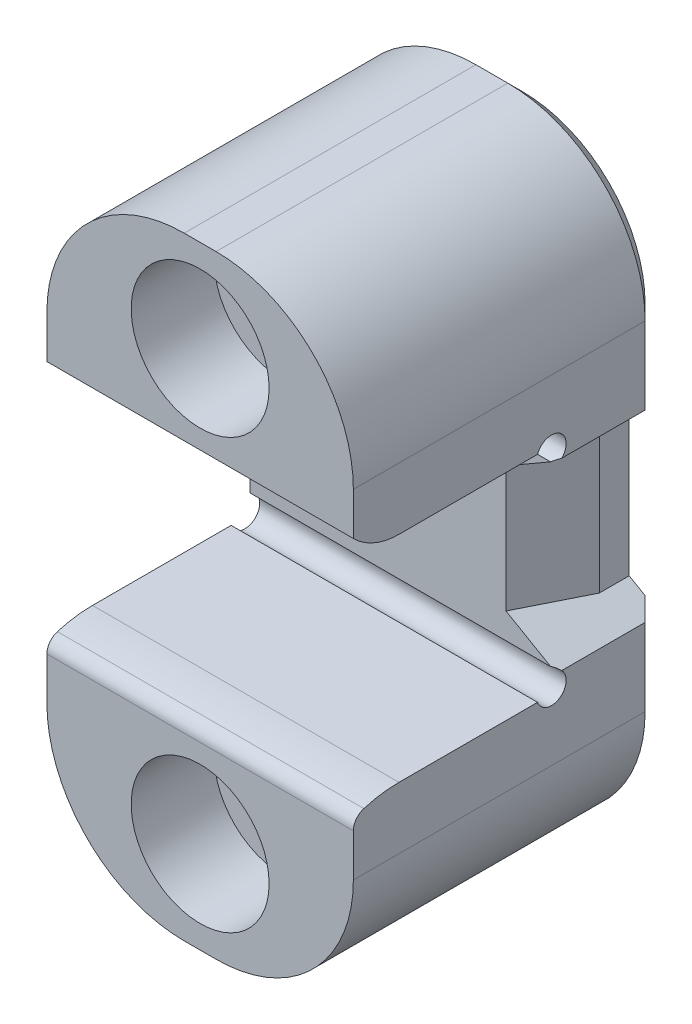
SolidWorks part; units mm, degrees
ref_plane "Front Plane" through (0, 0, 0) normal (0, 0, 1) x (1, 0, 0)
ref_plane "Top Plane" through (0, 0, 0) normal (0, 1, 0) x (1, 0, 0)
ref_plane "Right Plane" through (0, 0, 0) normal (1, 0, 0) x (0, 0, -1)
sketch "Sketch1" plane through (0, 0, 0) normal (1, 0, 0) x (0, 0, -1)
  line L0 (0, 0) -> (50000, 0) construction
  line L1 (0, 5.5626) -> (10.5156, 5.5626)
  line L2 (0, 15.875) -> (15.875, 15.875)
  line L3 (0, 15.875) -> (0, 5.5626)
  line L4 (0, -15.875) -> (15.875, -15.875)
  line L5 (15.875, 15.875) -> (15.875, -15.875)
  line L6 (10.5156, 5.5626) -> (10.5156, -5.5626)
  line L7 (10.5156, -5.5626) -> (0, -5.5626)
  line L9 (0, 8.7312) -> (0, -8.7312) construction
  line L10 (0, -5.5626) -> (0, -15.875)
  dimension "D1" = 15.875
  dimension "D2" = 31.75
  dimension "D3" = 10.5156
  dimension "D4" = 11.1252
extrude "Extrude1" add sketch "Sketch1" along normal mid plane 15.875
fillet "Fillet1" radius 7.112 4 edges at (-7.9375, -15.875, -7.9375) (-7.9375, 15.875, -7.9375) (7.9375, -15.875, -7.9375) (7.9375, 15.875, -7.9375)
sketch "Sketch2" plane through (-7.9375, 0, -15.875) normal (0, 0, 1) x (1, 0, 0)
  line L0 (0, 0) -> (50000, 0) construction
  line L1 (15.875, -8.763) -> (15.875, 8.763) construction
  line L2 (14.2875, 3.846) -> (17.4625, 5.679)
  line L3 (14.2875, 3.846) -> (14.2875, -3.846)
  line L4 (14.2875, -3.846) -> (17.4625, -5.679)
  line L5 (17.4625, 5.679) -> (17.4625, -5.679)
  point P4 (15.875, 4.7625)
  point P10 (15.875, -4.7625)
  dimension "D1" = 9.525
  dimension "D2" = 1.5875
  dimension "D3" = 30
  dimension "D4" = 3.175
extrude "Cut-Extrude1" cut sketch "Sketch2" along normal through all
sketch "Sketch5" plane through (7.9375, 0, 0) normal (1, 0, 0) x (0, 0, -1)
  line L0 (0, 0) -> (50000, 0) construction
  line L1 (0, 5.5626) -> (10.5156, 5.5626) construction
  line L2 (0, 8.763) -> (0, 5.5626) construction
  line L3 (0, -5.5626) -> (0, -8.763) construction
  line L4 (-3.9878, -3.3836) -> (2.3622, -3.3836)
  line L5 (-3.9878, -3.3836) -> (-3.9878, -6.5586)
  line L6 (-3.9878, -6.5586) -> (0, -6.5586)
  line L7 (2.3622, -3.3836) -> (2.3622, -5.5626)
  line L8 (10.5156, -5.5626) -> (0, -5.5626) construction
  line L9 (2.3622, 3.3836) -> (2.3622, 5.5626)
  line L10 (-3.9878, 6.5586) -> (0, 6.5586)
  line L11 (-3.9878, 3.3836) -> (-3.9878, 6.5586)
  line L12 (-3.9878, 3.3836) -> (2.3622, 3.3836)
  arc A0 (0.5438, -5.8285) -> (2.3622, -5.5626) centre (2.3622, -11.9126) cw
  arc A1 (0, -6.5586) -> (0.5438, -5.8285) centre (0.762, -6.5586) cw
  arc A2 (0, 6.5586) -> (0.5438, 5.8285) centre (0.762, 6.5586) ccw construction
  arc A3 (0.5438, 5.8285) -> (2.3622, 5.5626) centre (2.3622, 11.9126) ccw construction
  arc A4 (0, 6.5586) -> (2.3622, 5.5626) centre (2.3622, 8.8618) ccw
  dimension "D1" = 0.762
  dimension "D2" = 6.35
  dimension "D3" = 3.175
  dimension "D4" = 6.35
  dimension "D5" = 2.3622
extrude "Cut-Extrude2" cut sketch "Sketch5" against normal through all
sketch "Sketch6" plane through (7.9375, 0, 0) normal (1, 0, 0) x (0, 0, -1)
  line L0 (0, 0) -> (50000, 0) construction
  line L3 (10.5156, 5.5626) -> (10.5156, 4.7625) construction
  line L4 (2.3622, 5.5626) -> (10.5156, 5.5626) construction
  circle A0 centre (10.2616, 5.3086) radius 0.762
  circle A1 centre (10.2616, -5.3086) radius 0.762
  dimension "D2" = 0.508
  dimension "D3" = 0.762
  dimension "D1" = 0.508
extrude "Cut-Extrude3" cut sketch "Sketch6" against normal through all
hole_wizard "#6 CBORE" positions "Sketch4" profile "Sketch3" counterbore size "#6" standard "Ansi Inch"
sketch "Sketch4" plane through (0, 0, 0) normal (0, 0, 1) x (1, 0, 0)
  line L0 (0, 0) -> (0, 50000) construction
  line L1 (0, 0) -> (50000, 0) construction
  point P0 (0, 11.1125)
  point P12 (0, -11.1125)
  dimension "D1" = 22.225
sketch "Sketch3" plane through (0, 11.1125, 0) normal (1, 0, 0) x (0, -1, 0)
  line L0 (0, 0) -> (0, 15.875)
  line L1 (0, 15.875) -> (1.651, 15.875)
  line L3 (1.651, 15.875) -> (1.651, 4.3002)
  line L4 (1.651, 4.3002) -> (3.5725, 4.3002)
  line L5 (3.5725, 4.3002) -> (3.5725, 0)
  line L7 (3.5725, 0) -> (0, 0)
  line L11 (0, -6.35) -> (0, 107.95) construction
  dimension "Thru Hole Dia." = 3.302
  dimension "Thru Hole Depth" = 15.875
  dimension "C'Bore Dia." = 7.145
  dimension "C'Bore Depth" = 4.3002
chamfer "Chamfer3" distance 3.81 angle 15 1 edges at (6.35, 0, -10.5156)
chamfer "Chamfer1" distance 0.762 angle 45 9 edges at (-7.9375, 0, -15.875) (-5.8544, -13.7919, -15.875) (0, -15.875, -15.875) (0, 15.875, -15.875) (-5.8544, 13.7919, -15.875) (7.9375, -6.7627, -15.875) (5.8544, -13.7919, -15.875) (7.9375, 6.7628, -15.875) (5.8544, 13.7919, -15.875)
hole_wizard "#8-32 Tapped Hole1" positions "Sketch8" profile "Sketch7" tap size "#8-32" standard "Ansi Inch"
sketch "Sketch8" plane through (0, 0, -4.3002) normal (0, 0, 1) x (1, 0, 0)
  point P0 (0, 11.1125)
  point P1 (0, -11.1125)
sketch "Sketch7" plane through (0, 11.1125, -4.3002) normal (1, 0, 0) x (0, -1, 0)
  line L0 (0, 0) -> (0, 11.5748)
  line L1 (0, 11.5748) -> (1.7272, 11.5748)
  line L2 (1.7272, 11.5748) -> (1.7272, 0)
  line L5 (1.7272, 0) -> (0, 0)
  line L11 (0, -6.35) -> (0, 107.95) construction
  dimension "Thread Major Dia." = 3.4544
  dimension "Thru Tap Drill Depth" = 11.5748
